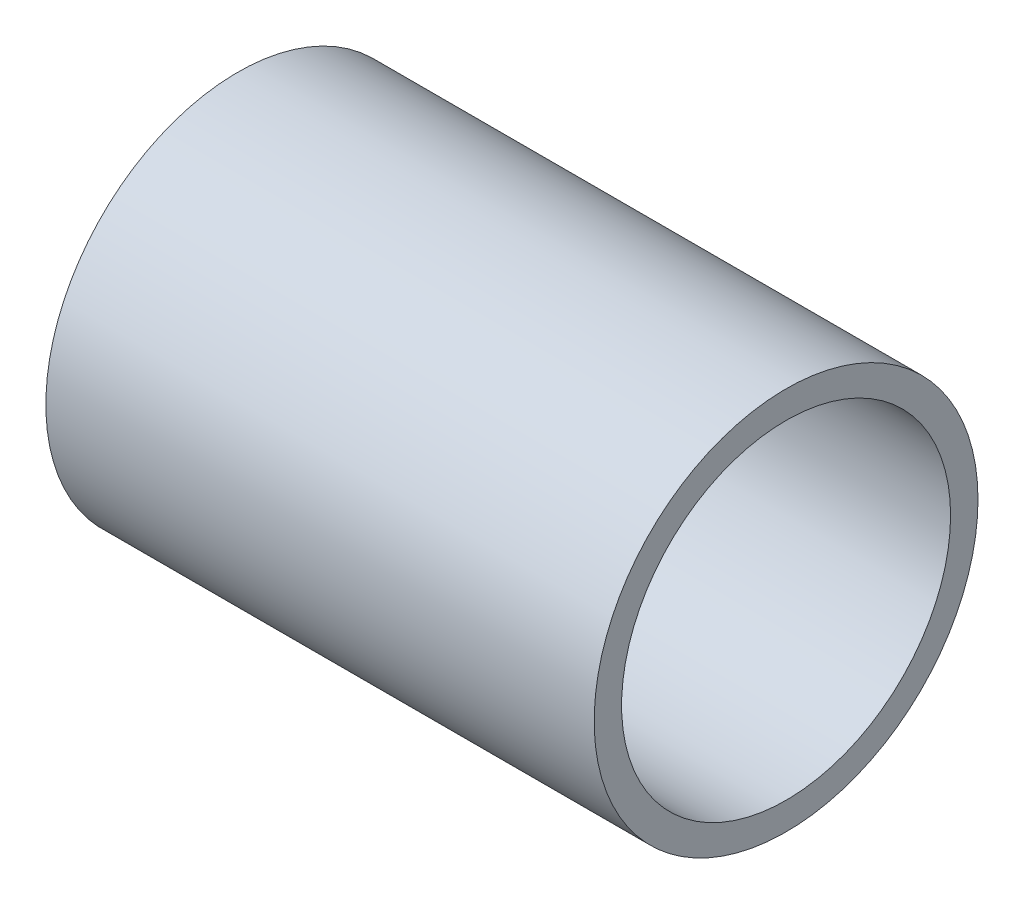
SolidWorks part; units mm, degrees
ref_plane "Front" through (0, 0, 0) normal (0, 0, 1) x (1, 0, 0)
ref_plane "Top" through (0, 0, 0) normal (0, 1, 0) x (1, 0, 0)
ref_plane "Right" through (0, 0, 0) normal (1, 0, 0) x (0, 0, -1)
sketch "Sketch1" plane through (0, 0, 0) normal (0, 0, 1) x (1, 0, 0)
  line L0 (0, 0) -> (127, 0)
  line L1 (9.9848, 0) -> (-9.9848, 0) construction
  dimension "D1" = 127
other "Structural Member1"
ref_plane "Plane1" through (0, 0, 0) normal (1, 0, 0) x (0, 0, -1)
sketch "Sketch11" plane through (0, 0, 0) normal (1, 0, 0) x (0, 0, -1)
  circle A0 centre (0, 0) radius 38.1
  circle A1 centre (0, 0) radius 44.45
  point P3 (0, 0)
  dimension "D1" = 88.9
  dimension "D2" = 76.2
ref_plane "Plane2" through (0, 0, 44.45) normal (0, 0, 1) x (1, 0, 0)
